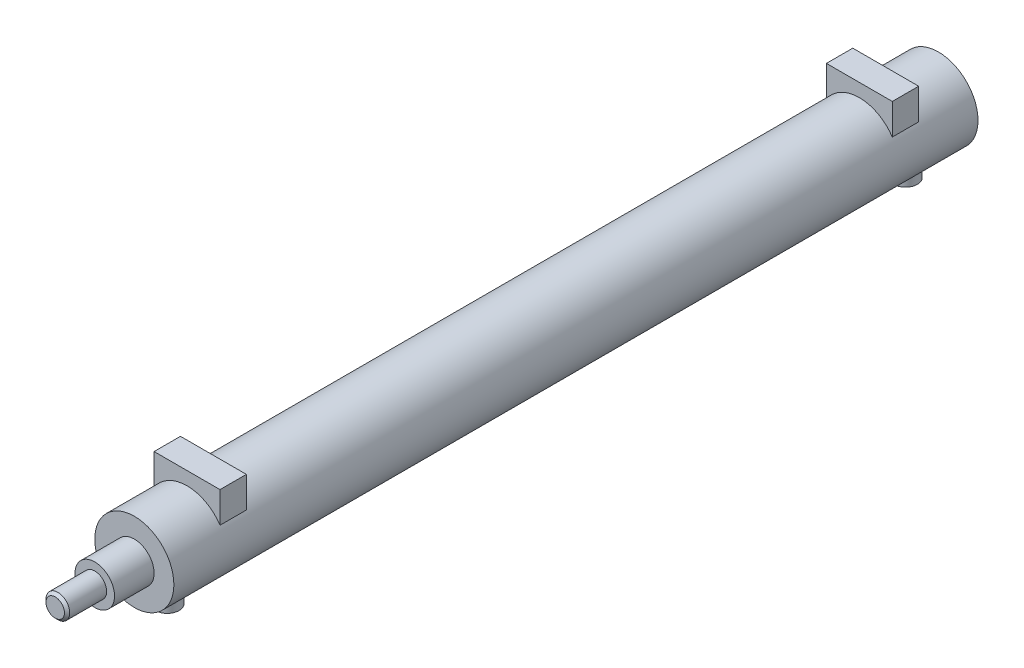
SolidWorks part; units mm, degrees
ref_plane "Płaszczyzna przednia" through (0, 0, 0) normal (0, 0, 1) x (1, 0, 0)
ref_plane "Płaszczyzna górna" through (0, 0, 0) normal (0, 1, 0) x (1, 0, 0)
ref_plane "Płaszczyzna prawa" through (0, 0, 0) normal (1, 0, 0) x (0, 0, -1)
sketch "Szkic1" plane through (0, 0, 0) normal (0, 0, 1) x (1, 0, 0)
  circle A0 centre (0, 0) radius 30
  dimension "D1" = 60
extrude "Dodanie-wyciągnięcie1" add sketch "Szkic1" along normal mid plane 610
sketch "Szkic3" plane through (0, 0, 305) normal (0, 0, 1) x (1, 0, 0)
  circle A0 centre (0, 0) radius 15
  dimension "D1" = 30
extrude "Dodanie-wyciągnięcie2" add sketch "Szkic3" along normal blind 30
sketch "Szkic9" plane through (0, 0, 0) normal (0, 1, 0) x (1, 0, 0)
  line L1 (25, 245) -> (-25, 245)
  line L2 (25, 245) -> (25, 265)
  line L3 (25, 265) -> (-25, 265)
  line L4 (-25, 245) -> (-25, 265)
  line L5 (25, 245) -> (-25, 265) construction
  line L6 (25, 265) -> (-25, 245) construction
  point P0 (0, 255)
  dimension "D1" = 50
  dimension "D2" = 20
  dimension "D3" = 255
extrude "Dodanie-wyciągnięcie6" add sketch "Szkic9" along normal blind 40
mirror "Lustro1" about plane through (0, 0, 0) normal (0, 0, 1) of "Dodanie-wyciągnięcie6"
sketch "Szkic10" plane through (0, 0, 335) normal (0, 0, 1) x (1, 0, 0)
  circle A0 centre (0, 0) radius 9
  dimension "D1" = 18
extrude "Dodanie-wyciągnięcie7" add sketch "Szkic10" along normal blind 30
chamfer "Sfazowanie1" distance 2 angle 45 1 edges at (9, 0, 365)
sketch "Szkic11" plane through (0, 0, 0) normal (0, 1, 0) x (1, 0, 0)
  line L0 (-30, -305) -> (30, -305) construction
  circle A0 centre (0, -280) radius 6.35
  circle A1 centre (0, -280) radius 9
  dimension "D2" = 12.7
  dimension "D3" = 18
  dimension "D1" = 25
extrude "Dodanie-wyciągnięcie8" add sketch "Szkic11" against normal blind 40
mirror "Lustro2" about plane through (0, 0, 0) normal (0, 0, 1) of "Dodanie-wyciągnięcie8"
